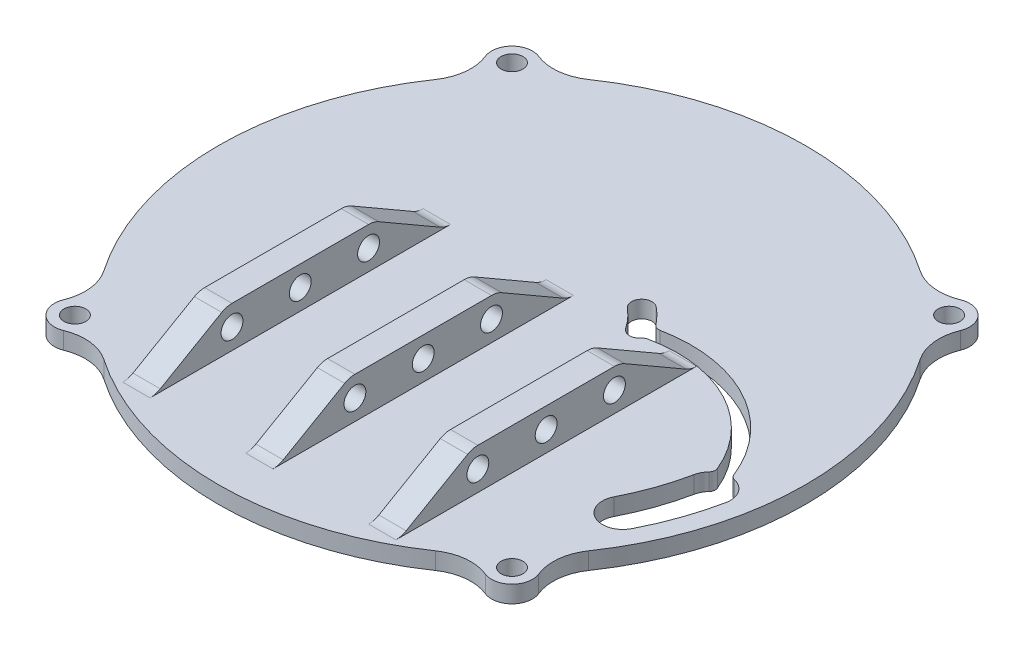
SolidWorks part; units mm, degrees
ref_plane "前视基准面" through (0, 0, 0) normal (0, 0, 1) x (1, 0, 0)
ref_plane "上视基准面" through (0, 0, 0) normal (0, 1, 0) x (1, 0, 0)
ref_plane "右视基准面" through (0, 0, 0) normal (1, 0, 0) x (0, 0, -1)
other "Configuration Table"
sketch "草图1" plane through (0, 0, 0) normal (0, 1, 0) x (1, 0, 0)
  line L0 (-32, 32) -> (32, 32) construction
  line L1 (-32, 32) -> (-32, -32) construction
  circle A0 centre (0, 0) radius 40 construction
  circle A3 centre (-32, 32) radius 1.6
  arc A4 (-34.7793, 30.8707) -> (-30.8707, 34.7793) centre (-32, 32) cw
  arc A5 (-30.8707, 34.7793) -> (-24.2826, 35.4874) centre (-28.2356, 41.2644) ccw
  arc A6 (-24.2826, 35.4874) -> (24.2826, 35.4874) centre (0, 0) cw
  arc A7 (-34.7793, 30.8707) -> (-35.4874, 24.2826) centre (-41.2644, 28.2356) cw
  arc A8 (30.8707, 34.7793) -> (34.7793, 30.8707) centre (32, 32) cw
  arc A9 (30.8707, 34.7793) -> (24.2826, 35.4874) centre (28.2356, 41.2644) cw
  arc A10 (34.7793, 30.8707) -> (35.4874, 24.2826) centre (41.2644, 28.2356) ccw
  arc A11 (35.4874, 24.2826) -> (35.4874, -24.2826) centre (0, 0) cw
  arc A12 (34.7793, -30.8707) -> (30.8707, -34.7793) centre (32, -32) cw
  arc A13 (34.7793, -30.8707) -> (35.4874, -24.2826) centre (41.2644, -28.2356) cw
  arc A14 (30.8707, -34.7793) -> (24.2826, -35.4874) centre (28.2356, -41.2644) ccw
  arc A15 (24.2826, -35.4874) -> (-24.2826, -35.4874) centre (0, 0) cw
  arc A16 (-30.8707, -34.7793) -> (-34.7793, -30.8707) centre (-32, -32) cw
  arc A17 (-30.8707, -34.7793) -> (-24.2826, -35.4874) centre (-28.2356, -41.2644) cw
  arc A18 (-34.7793, -30.8707) -> (-35.4874, -24.2826) centre (-41.2644, -28.2356) ccw
  arc A19 (-35.4874, -24.2826) -> (-35.4874, 24.2826) centre (0, 0) cw
  circle A20 centre (32, 32) radius 1.6
  circle A21 centre (32, -32) radius 1.6
  circle A22 centre (-32, -32) radius 1.6
  point P41 (0, 0)
  dimension "D2" = 80
  dimension "D3" = 4
  dimension "D4" = 3.2
  dimension "D7" = 43
  dimension "D8" = 7
  dimension "D9" = 3
  dimension "D5" = 32
  dimension "D6" = 32
  dimension "D12" = 90
  dimension "D13" = 64
  dimension "D14" = 64
  dimension "D10" = 2
  dimension "D11" = 2
extrude "凸台-拉伸1" add sketch "草图1" along normal blind 4
sketch "草图2" plane through (0, 4, 0) normal (0, 1, 0) x (1, 0, 0)
  circle A0 centre (0, 0) radius 50
  dimension "D1" = 100
extrude "切除-拉伸1" cut sketch "草图2" against normal blind 1.5
sketch "草图4" plane through (0, 2.5, 0) normal (0, 1, 0) x (1, 0, 0)
  line L2 (0, 0) -> (28.6276, 0) construction
  line L4 (10.5, 7.5) -> (38.5, 7.5) construction
  line L5 (10.5, 7.5) -> (10.5, -7.5) construction
  line L6 (10.5, -7.5) -> (38.5, -7.5) construction
  line L7 (38.5, 7.5) -> (38.5, -7.5) construction
  circle A2 centre (0, 0) radius 15 construction
  circle A3 centre (0, 0) radius 40 construction
  arc A4 (8.5345, 10.46) -> (11.225, 7.5) centre (0, 0) cw construction
  arc A5 (12.4722, 8.3333) -> (9.4828, 11.6222) centre (0, 0) ccw
  arc A6 (9.9778, 6.6667) -> (7.5863, 9.2978) centre (0, 0) ccw
  arc A7 (9.9778, 6.6667) -> (12.4722, 8.3333) centre (11.225, 7.5) ccw
  arc A8 (9.4828, 11.6222) -> (7.5863, 9.2978) centre (8.5345, 10.46) ccw
  arc A9 (36.4872, -7.5) -> (33.1772, -16.9363) centre (0, 0) cw construction
  arc A10 (35.8491, -18.3003) -> (39.4257, -8.104) centre (0, 0) ccw
  arc A11 (30.5052, -15.5723) -> (33.5486, -6.896) centre (0, 0) ccw
  arc A12 (30.5052, -15.5723) -> (35.8491, -18.3003) centre (33.1772, -16.9363) ccw
  arc A13 (39.4257, -8.104) -> (33.5486, -6.896) centre (36.4872, -7.5) ccw
  point P2 (9.99, 9.0802)
  point P12 (38.5, 0)
  point P18 (35.1503, -12.3297)
  dimension "D4" = 80
  dimension "D5" = 30
  dimension "D6" = 3
  dimension "D7" = 6
  dimension "D1" = 15
  dimension "D2" = 28
  dimension "D3" = 10.5
  dimension "D8" = 4
  dimension "D9" = 10
  dimension "D10" = 40.25
extrude "切除-拉伸2" cut sketch "草图4" against normal through all
sketch "草图6" plane through (0, 0, 0) normal (1, 0, 0) x (0, 0, -1)
  line L0 (-36.1962, 2.5) -> (-25.8038, 8.5)
  line L1 (24.2826, 2.5) -> (-24.2826, 2.5) construction
  line L2 (-25.8038, 8.5) -> (-4.1962, 8.5)
  line L3 (-4.1962, 8.5) -> (6.1962, 2.5)
  line L4 (35, 2.5) -> (30.8707, 2.5) construction
  line L5 (6.1962, 2.5) -> (-36.1962, 2.5)
  line L6 (-25, 5.5) -> (-15, 5.5) construction
  circle A0 centre (-25, 5.5) radius 1.6
  circle A2 centre (-15, 5.5) radius 1.6
  circle A3 centre (-5, 5.5) radius 1.6
  point P10 (-15, 8.5)
  dimension "D1" = 3.2
  dimension "D2" = 3
  dimension "D3" = 10
  dimension "D4" = 3
  dimension "D5" = 6
  dimension "D6" = 30
  dimension "D7" = 30
  dimension "D8" = 15
  dimension "D9" = 3
extrude "凸台-拉伸2" add sketch "草图6" along normal mid plane 40
sketch "草图7" plane through (0, 8.5, 0) normal (0, 1, 0) x (1, 0, 0)
  line L0 (20, -36.1962) -> (-20, -36.1962) construction
  line L1 (-16, -36.1962) -> (-2, -36.1962)
  line L2 (-16, -36.1962) -> (-16, 6.1962)
  line L3 (-16, 6.1962) -> (-2, 6.1962)
  line L4 (-2, -36.1962) -> (-2, 6.1962)
  line L5 (20, 6.1962) -> (11.9666, 6.1962) construction
  line L6 (20, -36.1962) -> (20, 6.1962) construction
  line L7 (2, -36.1962) -> (16, -36.1962)
  line L8 (2, -36.1962) -> (2, 6.1962)
  line L9 (2, 6.1962) -> (16, 6.1962)
  line L10 (16, -36.1962) -> (16, 6.1962)
  line L11 (-20, 6.1962) -> (-20, -4.1962) construction
  dimension "D1" = 4
  dimension "D2" = 4
  dimension "D3" = 2
  dimension "D4" = 2
extrude "切除-拉伸3" cut sketch "草图7" against normal blind 6
fillet "圆角1" radius 3 12 edges at (18, 2.5, -6.1962) (18, 8.5, 4.1962) (-18, 8.5, 4.1962) (-18, 2.5, -6.1962) (0, 2.5, -6.1962) (0, 8.5, 4.1962) (18, 8.5, 25.8038) (18, 2.5, 36.1962) (0, 8.5, 25.8038) (0, 2.5, 36.1962) (-18, 2.5, 36.1962) (-18, 8.5, 25.8038)
sketch "草图8" plane through (0, 2.5, 0) normal (0, 1, 0) x (1, 0, 0)
  arc A0 (11.225, 7.5) -> (36.4872, -7.5) centre (16.9267, -11.67) cw construction
  arc A1 (37.4652, -7.2915) -> (10.9399, 8.4585) centre (16.9267, -11.67) ccw
  arc A2 (35.5091, -7.7085) -> (11.5101, 6.5415) centre (16.9267, -11.67) ccw
  arc A3 (35.5091, -7.7085) -> (37.4652, -7.2915) centre (36.4872, -7.5) ccw
  arc A4 (10.9399, 8.4585) -> (11.5101, 6.5415) centre (11.225, 7.5) ccw
  point P3 (27.1378, 5.5269)
  point P10 (28.0467, 6.1187)
  dimension "D1" = 1
  dimension "D2" = 19
extrude "切除-拉伸4" cut sketch "草图8" along normal through all both and the other way through all
fillet "圆角2" radius 1 4 edges at (12.563, 1.25, -6.8221) (12.1605, 1.25, -8.7819) (34.7402, 1.25, 5.0611) (36.6667, 1.25, 4.5054)
